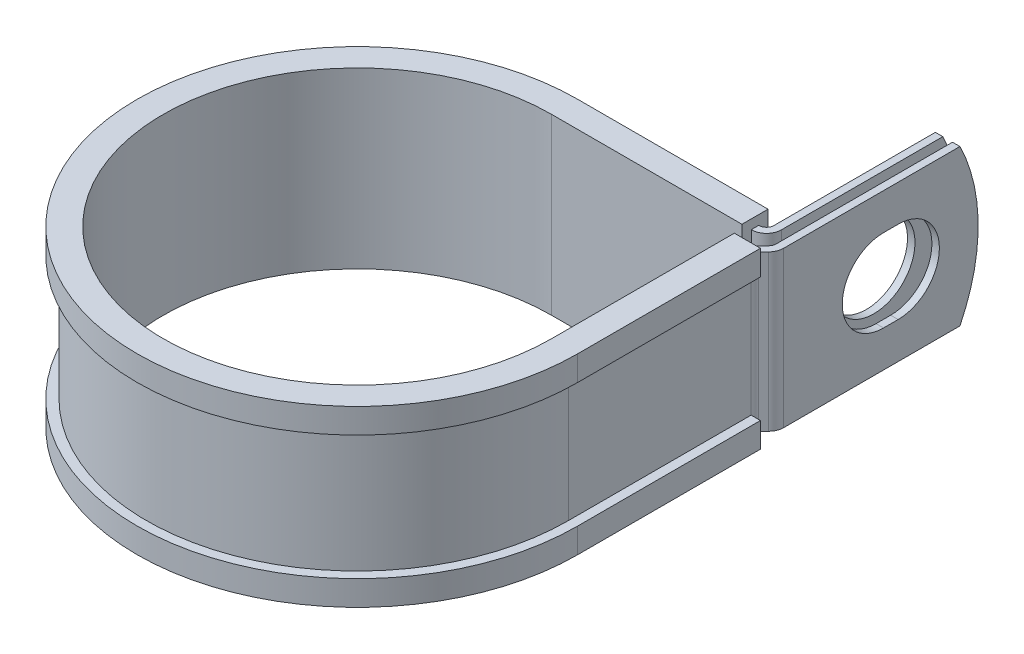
SolidWorks part; units mm, degrees
ref_plane "Front Plane" through (0, 0, 0) normal (0, 0, 1) x (1, 0, 0)
ref_plane "Top Plane" through (0, 0, 0) normal (0, 1, 0) x (1, 0, 0)
ref_plane "Right Plane" through (0, 0, 0) normal (1, 0, 0) x (0, 0, -1)
sketch "Sketch1" plane through (0, 0, 0) normal (0, 1, 0) x (1, 0, 0)
  line L0 (0, 33.274) -> (31.1583, 33.274)
  line L1 (33.274, 0) -> (33.274, 29.8615)
  line L2 (33.5967, 65.0748) -> (33.5967, 35.7124)
  line L3 (33.9882, 31.5857) -> (34.8144, 32.4119)
  line L5 (35.1715, 33.274) -> (35.1715, 65.0748)
  arc A0 (0, 33.274) -> (33.274, 0) centre (0, 0) ccw
  arc A1 (33.9882, 31.5857) -> (33.274, 29.8615) centre (35.7124, 29.8615) ccw
  arc A2 (34.8144, 32.4119) -> (35.1715, 33.274) centre (33.9523, 33.274) ccw
  arc A3 (31.1583, 33.274) -> (33.5967, 35.7124) centre (31.1583, 35.7124) ccw
extrude "Extrude-Thin1" add sketch "Sketch1" along normal mid plane 25.4 thin
sketch "Sketch2" plane through (32.3775, 0, 0) normal (-1, 0, 0) x (0, 0, 1)
  line L0 (-65.0748, 12.7) -> (-65.0748, -12.7) construction
  line L1 (0, 12.7) -> (0, -12.7) construction
  circle A0 centre (-50.8, 0) radius 6.7437
  point P2 (-65.0748, 0)
extrude "Cut-Extrude1" cut sketch "Sketch2" against normal up to surface (1.2192 mm away)
sketch "Sketch3" plane through (36.3907, 0, 0) normal (1, 0, 0) x (0, 0, -1)
  line L0 (49.6062, 0) -> (51.9938, 0) construction
  line L1 (49.6062, 6.7437) -> (51.9938, 6.7437)
  line L2 (49.6062, -6.7437) -> (51.9938, -6.7437)
  line L3 (65.0748, 12.7) -> (65.0748, -12.7) construction
  arc A0 (49.6062, 6.7437) -> (49.6062, -6.7437) centre (49.6062, 0) ccw
  arc A1 (51.9938, -6.7437) -> (51.9938, 6.7437) centre (51.9938, 0) ccw
  point P3 (50.8, 0)
  point P8 (65.0748, 0)
  point P11 (42.8625, 0)
  point P12 (58.7375, 0)
extrude "Cut-Extrude2" cut sketch "Sketch3" against normal up to surface (1.2192 mm away)
sketch "Sketch4" plane through (32.3775, 0, 0) normal (-1, 0, 0) x (0, 0, 1)
  line L0 (-65.0748, 12.7) -> (-65.0748, -12.7)
  line L1 (-65.0748, 12.7) -> (-62.0975, 12.7)
  line L2 (-65.0748, 12.7) -> (-35.7124, 12.7) construction
  line L3 (-65.0748, -12.7) -> (-62.0975, -12.7)
  line L4 (-65.0748, -12.7) -> (-35.7124, -12.7) construction
  arc A0 (-62.0975, 12.7) -> (-62.0975, -12.7) centre (-36.4998, 0) ccw
extrude "Cut-Extrude3" cut sketch "Sketch4" against normal through all contours A0 M4 M5 | A0 L0 M2
ref_plane "Plane1" through (0, 0, -29.8615) normal (0, 0, -1) x (-1, 0, 0)
ref_plane "Plane2" through (31.1075, 0, 0) normal (-1, 0, 0) x (0, 0, 1)
sketch "Sketch5" plane through (0, 0, -29.8615) normal (0, 0, -1) x (-1, 0, 0)
  line L0 (-34.4932, 12.7) -> (-33.274, 12.7)
  line L1 (-34.4932, 12.7) -> (-34.4932, -12.7) construction
  line L3 (-33.274, 12.7) -> (-33.274, -12.7)
  line L4 (-33.274, -12.7) -> (-34.4932, -12.7)
  line L5 (-34.4932, -12.7) -> (-34.4932, -10.16)
  line L6 (-34.4932, 12.7) -> (-34.4932, 10.16)
  line L7 (-36.0172, 14.224) -> (-36.0172, 10.16)
  line L8 (-36.0172, 14.224) -> (-31.75, 14.224)
  line L9 (-31.75, 14.224) -> (-31.75, -14.224)
  line L10 (-31.75, -14.224) -> (-36.0172, -14.224)
  line L11 (-36.0172, -14.224) -> (-36.0172, -10.16)
  line L12 (-36.0172, 10.16) -> (-34.4932, 10.16)
  line L13 (-34.4932, -10.16) -> (-36.0172, -10.16)
sketch "Sketch6" plane through (0, 12.7, 0) normal (0, 1, 0) x (1, 0, 0)
  line L0 (31.75, 0) -> (31.75, 29.8615)
  line L1 (31.75, 29.8615) -> (36.0172, 29.8615) construction
  line L2 (31.1075, 6.9878) -> (31.1075, -6.9878) construction
  line L5 (0, 31.75) -> (31.1075, 31.75)
  arc A0 (0, 31.75) -> (31.75, 0) centre (0, 0) ccw
sweep "Sweep1" add profiles "Sketch5" path "Sketch6"
equation "\"D4@Sketch5\" = \"D1@Extrude-Thin1\""
equation "\"D5@Sketch5\" = \"D5@Extrude-Thin1\""
equation "\"D1@Sketch3\" = \"D2@Sketch2\""
equation "\"D7@Sketch1\" = \"D3@Sketch2\" + \"D1@Sketch3\""
equation "\"D1@Sketch1\" = \"D1@Sketch6\" + 2 * \"D3@Sketch5\""
equation "\"D1@Sketch4\" = ( \"D1@Extrude-Thin1\" + .125 ) * 2"
equation "\"D9@Sketch1\"= \"D5@Extrude-Thin1\""
equation "\"D8@Sketch1\"= 2 * \"D5@Extrude-Thin1\""
equation "\"D2@Sketch1\" = 2 * \"D5@Extrude-Thin1\""
equation "\"D2@Sketch3\" = \"D1@Sketch2\""
